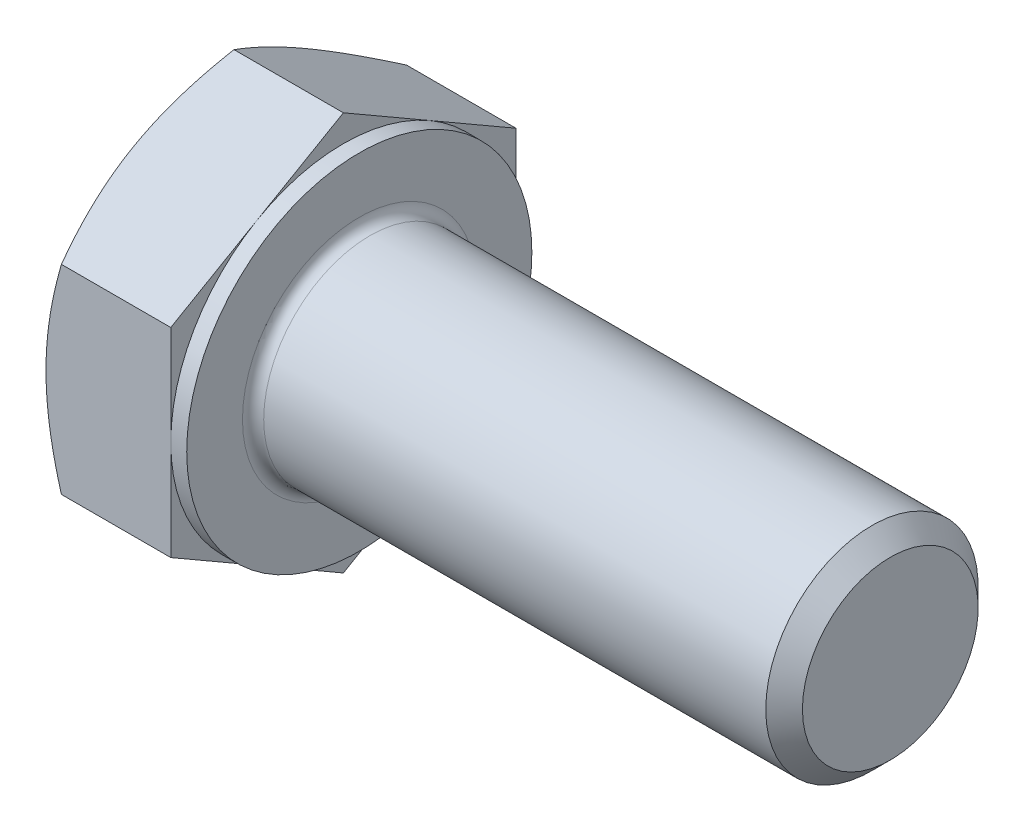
SolidWorks part; units mm, degrees
ref_plane "Plane1" through (0, 0, 0) normal (0, 0, 1) x (1, 0, 0)
ref_plane "Plane2" through (0, 0, 0) normal (0, 1, 0) x (1, 0, 0)
ref_plane "Plane3" through (0, 0, 0) normal (1, 0, 0) x (0, 0, -1)
extrude "BaseHead" add sketch "Sketch1" along normal blind 5.3
sketch "Sketch1" plane through (0, 0, 0) normal (1, 0, 0) x (0, 0, -1)
  line L0 (6.5, 3.7528) -> (6.5, -3.7528)
  line L1 (-6.5, 3.7528) -> (-6.5, -3.7528)
  line L2 (6.5, -3.7528) -> (0, -7.5056)
  line L3 (0, -7.5056) -> (-6.5, -3.7528)
  line L4 (6.5, 3.7528) -> (0, 7.5056)
  line L5 (0, 7.5056) -> (-6.5, 3.7528)
  dimension "Width_flats" = 13
  dimension "D2" = 120
  dimension "D3" = 6.5
  dimension "D4" = 6.5
  dimension "D5" = 6.5
revolve "BearingFace" cut sketch "Sketch4"
sketch "Sketch4"
  line L1 (5.3, 7.5056) -> (5.3, 3.7528) construction
  line L2 (5.3, 6.5) -> (4.7, 6.5)
  line L3 (5.3, 6.5) -> (5.3, 17.5056)
  line L4 (5.3, 17.5056) -> (4.7, 17.5056)
  line L5 (0, 0) -> (95.25, 0) construction
  line L6 (0, 0) -> (96.52, 0) construction
  line L7 (4.7, 6.5) -> (4.7, 17.5056)
  line L8 (5.3, 7.5056) -> (0.5806, 7.5056) construction
revolve "HeadChamfer" cut sketch "Sketch3" angle 360 about L6
sketch "Sketch3" plane through (0, 0, 0) normal (0, 0, 1) x (1, 0, 0)
  line L0 (0, 6.5) -> (3.4673, 12.5056)
  line L1 (0, 7.5056) -> (0, 3.7528) construction
  line L2 (3.4673, 12.5056) -> (3.4673, 17.5056)
  line L3 (3.4673, 17.5056) -> (-10, 17.5056)
  line L4 (-10, 17.5056) -> (-10, 6.5)
  line L5 (-10, 6.5) -> (0, 6.5)
  line L6 (0, 0) -> (99.06, 0) construction
  line L7 (5.3, 7.5056) -> (0, 7.5056) construction
  dimension "D1" = 6.5
  dimension "D2" = 5
  dimension "D3" = 10
  dimension "D4" = 5
  dimension "Head_ch_ang" = 30
sketch "BodySke" plane through (0, 0, 0) normal (0, 0, 1) x (1, 0, 0)
  line L0 (0, 3.7528) -> (0, -3.7528) construction
  line L1 (0, 0) -> (25.3, 0)
  line L2 (0, 0) -> (0, 4)
  line L3 (0, 4) -> (24.6095, 4)
  line L4 (25.3, 0) -> (25.3, 3.3095)
  line L5 (5.3, 7.5056) -> (5.3, 3.7528) construction
  line L6 (25.3, 3.3095) -> (24.6095, 4)
  line L7 (0, 0) -> (96.52, 0) construction
  line L8 (25.3, -3.3095) -> (24.6095, -4) construction
  line L9 (0, -4) -> (24.6095, -4) construction
  line L10 (6.55, 15.24) -> (6.55, -1.27) construction
  line L11 (3.3, 15.24) -> (3.3, -1.27) construction
  line L12 (5.3, 3.7528) -> (5.3, -3.7528) construction
  dimension "Length" = 20
  dimension "Body_ch_ang" = 45
  dimension "Diameter" = 8
  dimension "Minor_dia" = 6.619
  dimension "Advance" = 1.25
  dimension "Thread_nom" = 22
revolve "BaseBody" add sketch "BodySke"
fillet "HeadFillet" radius 0.4 1 edges at (5.3, 0, -4)
sketch "ThdSchSke" plane through (0, 0, 0) normal (0, 0, 1) x (1, 0, 0)
  line L0 (6.55, -3.3095) -> (6.0665, -4)
  line L1 (6.55, -3.3095) -> (7.0335, -4)
  line L2 (7.0335, -4) -> (7.0335, -5)
  line L3 (-3.175, 0) -> (5.1513, 0) construction
  line L5 (7.0335, -5) -> (6.0665, -5)
  line L6 (6.0665, -5) -> (6.0665, -4)
  dimension "Thread_minor" = 6.619
  dimension "Diameter" = 8
  dimension "Start" = 6.55
  dimension "SideAngle" = 55
  dimension "VeeAngle" = 70
  dimension "Overcut" = 10
revolve "ThreadSchematic" [suppressed] cut sketch "ThdSchSke" angle 360 about L3
pattern_linear "ThdSchPat" [suppressed]
equation "\"D3@Sketch1\" = \"Width_flats@Sketch1\" / 2"
equation "\"D4@Sketch1\" = \"D3@Sketch1\""
equation "\"D5@Sketch1\" = \"D4@Sketch1\""
equation "\"Thread_minor@ThreadCosmetic\" = \"Minor_dia@BodySke\""
equation "\"D1@Sketch3\" = \"Width_flats@Sketch1\" / 2"
equation "\"D1@Sketch4\" = \"Width_flats@Sketch1\""
equation "\"Thread_length@ThreadCosmetic\" = ((sgn( (\"Length@BodySke\" - \"Advance@BodySke\" ) - \"Thread_nom@BodySke\" )-1)*( (\"Length@BodySke\" - \"Advance@BodySke\" ) - \"Thread_nom@BodySke\" ))/-2+ \"Thread_nom@BodySke\""
equation "\"Thread_minor@ThdSchSke\" = \"Minor_dia@BodySke\""
equation "\"Diameter@ThdSchSke\" = \"Diameter@BodySke\""
equation "\"Overcut@ThdSchSke\" = \"Diameter@BodySke\" * 1.25"
equation "\"Start@ThdSchSke\" = \"Head_ht@BaseHead\" + \"Length@BodySke\" - \"Thread_length@ThreadCosmetic\"  '---Non-countersunk---"
equation "\"Num_threads@ThdSchPat\" = int( \"Thread_length@ThreadCosmetic\" / \"Advance@BodySke\" + 0.999 )  + 1"
equation "\"Advance@ThdSchPat\" = \"Thread_length@ThreadCosmetic\" /  (\"Num_threads@ThdSchPat\" - 1) 'relax it"
equation "\"Num_threads@ThdSchPat\" = \"Num_threads@ThdSchPat\" - sgn( \"Num_threads@ThdSchPat\" - 1) '---chamfered tips only---"
